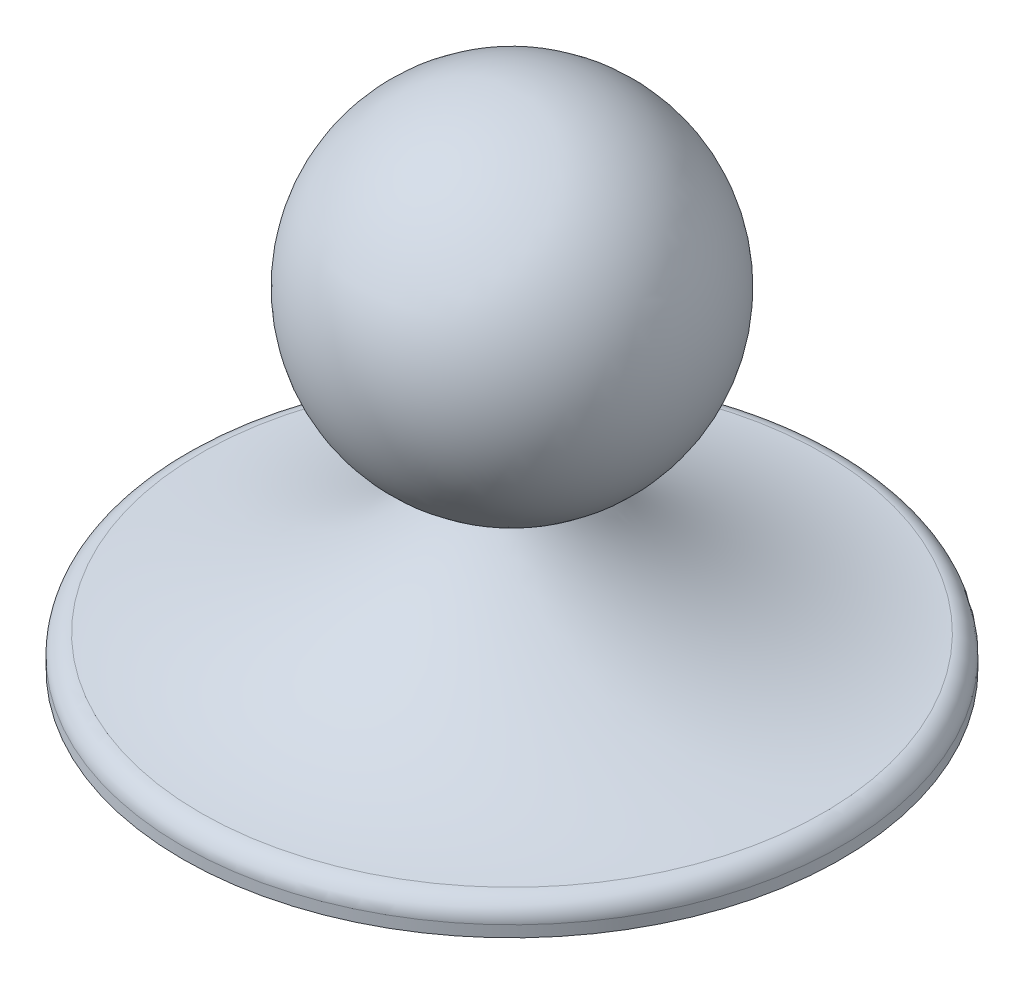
SolidWorks part; units mm, degrees
ref_plane "Ebene vorne" through (0, 0, 0) normal (0, 0, 1) x (1, 0, 0)
ref_plane "Ebene oben" through (0, 0, 0) normal (0, 1, 0) x (1, 0, 0)
ref_plane "Ebene rechts" through (0, 0, 0) normal (1, 0, 0) x (0, 0, -1)
sketch "Skizze1" plane through (0, 0, 0) normal (0, 0, 1) x (1, 0, 0)
  line L0 (0, 42.0265) -> (0, -11.9268) construction
  line L1 (0, 0) -> (20, 0)
  line L2 (20, 0) -> (20, 2)
  line L3 (20, 2) -> (25, 2)
  line L4 (25, 2) -> (25, 4.2741)
  arc A0 (0, 14.146) -> (0, 40) centre (0, 27.073) ccw
  arc A1 (0, 14.146) -> (0, 40) centre (0, 27.073) ccw
  spline S0 degree 3 poles (25, 4.2741) (16.0014, 4.515) (6.9981, 10.0524) (4.0424, 14.7944) knots 0 0 0 0 1 1 1 1
  dimension "D1" = 2
  dimension "D2" = 20
  dimension "D3" = 25
revolve "Rotation1" add sketch "Skizze1" angle 360 about L0
fillet "Verrundung1" radius 1.5 1 edges at (0, 4.2741, 25)
